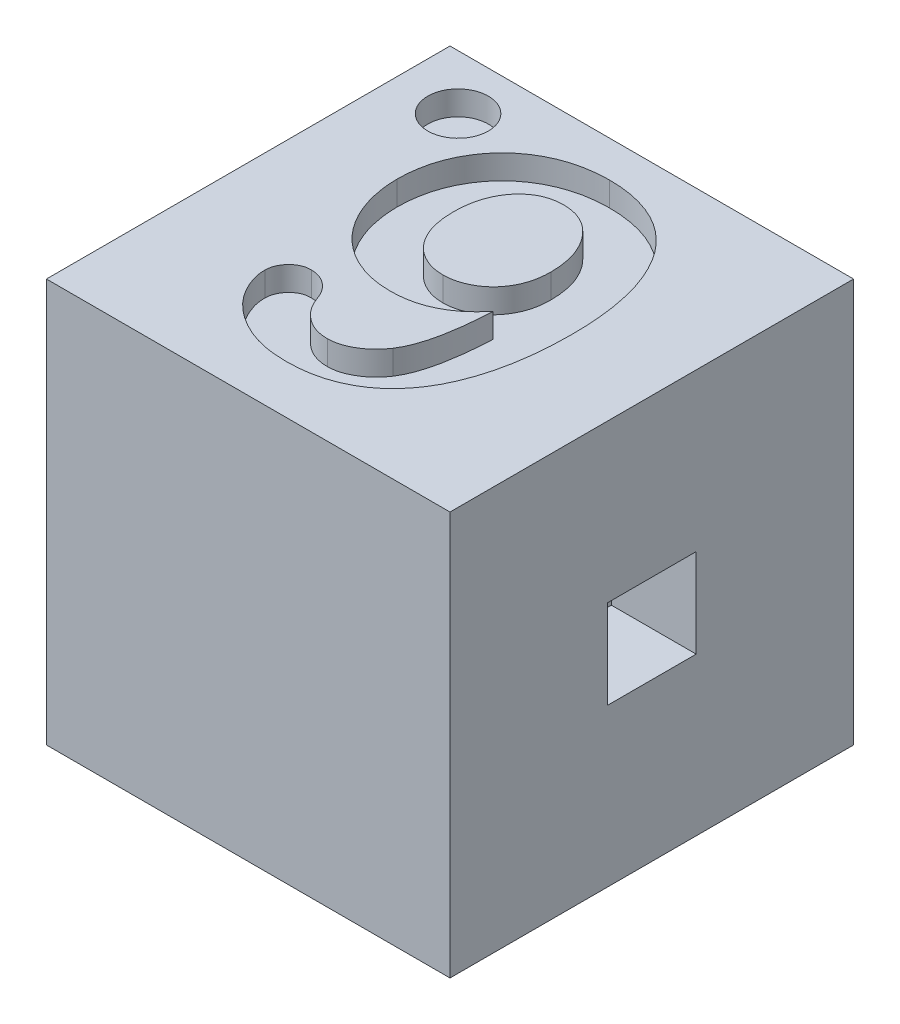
SolidWorks part; units mm, degrees
ref_plane "Front Plane" through (0, 0, 0) normal (0, 0, 1) x (1, 0, 0)
ref_plane "Top Plane" through (0, 0, 0) normal (0, 1, 0) x (1, 0, 0)
ref_plane "Right Plane" through (0, 0, 0) normal (1, 0, 0) x (0, 0, -1)
sketch "Sketch1" plane through (0, 0, 0) normal (0, 0, 1) x (1, 0, 0)
  line L1 (-5, 5) -> (5, 5)
  line L2 (-5, 5) -> (-5, -5)
  line L3 (-5, -5) -> (5, -5)
  line L4 (5, 5) -> (5, -5)
  point P4 (0, 5)
  point P6 (5, 0)
  dimension "D1" = 10
extrude "Boss-Extrude1" add sketch "Sketch1" along normal blind 10
sketch "Sketch2" plane through (-5, 0, 0) normal (1, 0, 0) x (0, 1, 0)
  line L0 (-5, 10) -> (-5, 0) construction
  line L1 (-1, 6) -> (1, 6)
  line L2 (-1, 6) -> (-1, 4)
  line L3 (-1, 4) -> (1, 4)
  line L4 (1, 6) -> (1, 4)
  point P4 (0, 4)
  point P8 (-5, 5)
  point P9 (1, 5)
  dimension "D1" = 2
extrude "Boss-Extrude2" add sketch "Sketch2" against normal blind 2
sketch "Sketch3" plane through (5, 0, 0) normal (-1, 0, 0) x (0, 1, 0)
  line L8 (-1.1, -6.1) -> (1.1, -6.1)
  line L9 (1.1, -6.1) -> (1.1, -3.9)
  line L10 (1.1, -3.9) -> (-1.1, -3.9)
  line L11 (-1.1, -3.9) -> (-1.1, -6.1)
  line L12 (-1.1, -6.1) -> (1.1, -6.1)
  line L13 (1.1, -6.1) -> (1.1, -3.9)
  line L14 (1.1, -3.9) -> (-1.1, -3.9)
  line L15 (-1.1, -3.9) -> (-1.1, -6.1)
  dimension "D1" = 0.1
extrude "Cut-Extrude1" cut sketch "Sketch3" along normal blind 2.1
sketch "TextSketch" plane through (0, 5, 0) normal (0, -1, 0) x (0, 0, 1)
  line L0 (1, 4.7514) -> (1, -4.7514) construction
  text T0 "6" font "Arial Rounded MT Bold" height 8
  point P3 (1, 0)
  point P4 (0.8932, 3.3667)
  point P5 (0.9627, 4.7514)
  dimension "D1" = 1
extrude "Cut-Extrude2" cut sketch "TextSketch" along normal blind 0.6
sketch "Sketch4" plane through (0, 5, 0) normal (0, 1, 0) x (1, 0, 0)
  line L0 (-5, -10) -> (-5, 0) construction
  line L1 (5, 0) -> (-5, 0) construction
  circle A0 centre (-3.45, -1.35) radius 0.75
  point P2 (-4.2, -1.35)
  point P3 (-3.45, -0.6)
  dimension "D1" = 1.5
  dimension "D2" = 0.8
  dimension "D3" = 0.6
extrude "Cut-Extrude3" cut sketch "Sketch4" against normal blind 0.6
